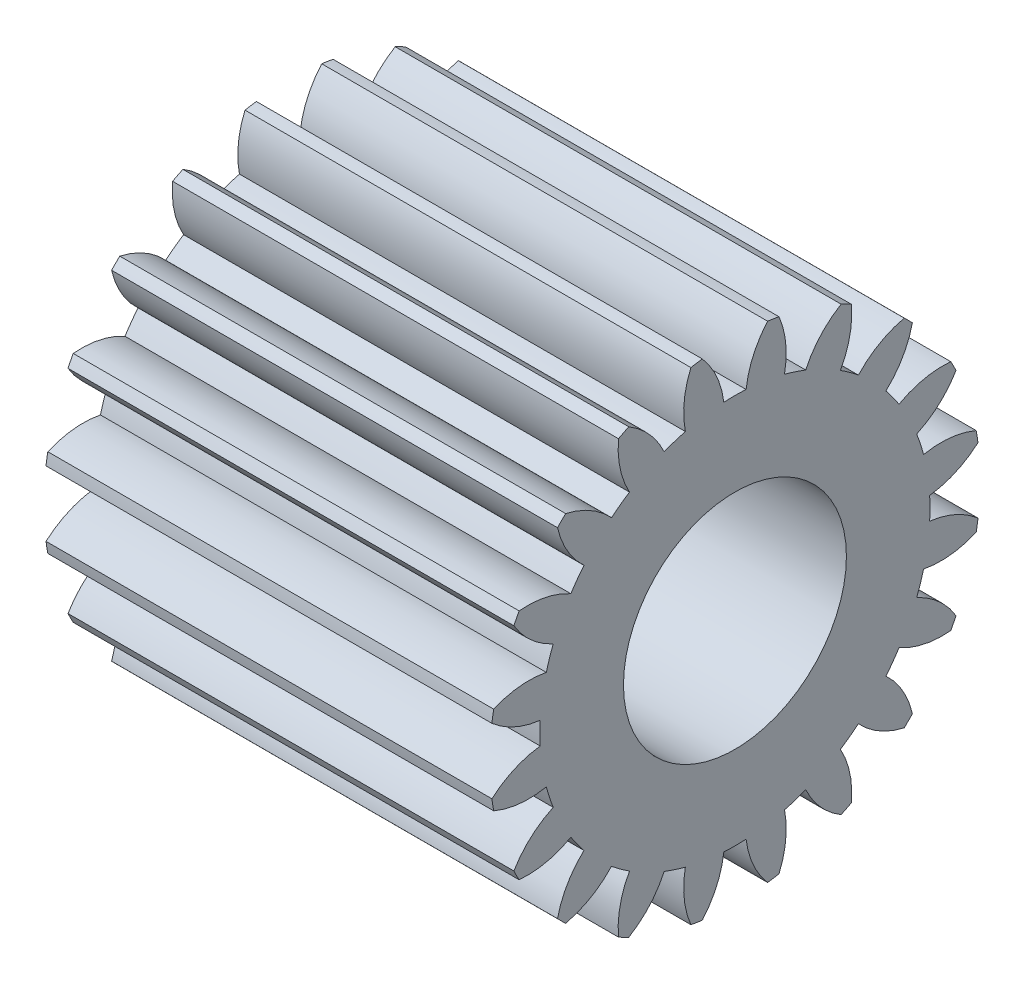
SolidWorks part; units mm, degrees
ref_plane "Plane1" through (0, 0, 0) normal (0, 0, 1) x (1, 0, 0)
ref_plane "Plane2" through (0, 0, 0) normal (0, 1, 0) x (1, 0, 0)
ref_plane "Plane3" through (0, 0, 0) normal (1, 0, 0) x (0, 0, -1)
other "Configuration Table"
sketch "HoldingSke" plane through (0, 0, 0) normal (0, 1, 0) x (1, 0, 0)
  line L0 (0, 0) -> (1.8794, -0.684)
  line L1 (-15, 0) -> (100, 0) construction
  line L2 (0, 0) -> (-2.1039, 2.3779)
  line L3 (0, 0) -> (-11.863, 4.5341)
  line L4 (0, 0) -> (8.1152, 2.9537)
  line L5 (0, 0) -> (-46.8476, -17.4728)
  line L6 (0, 0) -> (-8.2896, -5.593)
  line L7 (-2.1039, 2.3779) -> (8.6586, 51.2059)
  line L8 (-76.2, 54.61) -> (-75.3, 54.61)
  line L9 (-71.009, 38.7566) -> (-53.1078, 45.2721)
  line L10 (-76.2, 71.12) -> (104.1128, 71.12)
  line L11 (0, 0) -> (-10, 0)
  line L12 (-76.2, 101.6) -> (-76.181, 101.6)
  line L13 (24.9733, 27.94) -> (52.9518, 28.4284)
  line L14 (24.9733, 27.94) -> (24.9743, 27.94)
  line L15 (24.9733, 27.94) -> (100.4006, 29.5858)
  line L16 (-63.627, -0.5) -> (-12.827, -0.5)
  circle A0 centre (0, 0) radius 2.5
  circle A1 centre (0, 0) radius 4.374
  circle A2 centre (0, 0) radius 37.5
  circle A3 centre (0, 0) radius 2.5
sketch "BasProSke" plane through (0, 0, 0) normal (0, 1, 0) x (1, 0, 0)
  line L0 (-10, 0) -> (60, 0) construction
  line L1 (0, 0) -> (0, 5.5)
  line L2 (0, 0) -> (10, 0)
  line L3 (10, 0) -> (10, 5.5)
  line L4 (10, 5.5) -> (0, 5.5)
revolve "Base-Revolve" add sketch "BasProSke" angle 360 about L0
sketch "TooCutSke" plane through (0, 0, 0) normal (1, 0, 0) x (0, 0, -1)
  line L1 (0, 0) -> (0, 107) construction
  line L2 (0, 0) -> (-0.4255, 4.9819) construction
  line L3 (0, 0) -> (-1.5603, 9.8514) construction
  line L4 (-0.4255, 4.9819) -> (-0.7802, 4.9257) construction
  arc A0 (0.2499, 4.3669) -> (-0.2499, 4.3669) centre (0, 0) ccw
  arc A1 (0.7528, 5.4739) -> (-0.7528, 5.4739) centre (0, 0) ccw
  circle A2 centre (0, 0) radius 5 construction
  circle A3 centre (0, 0) radius 4.6985 construction
  arc A4 (-0.2499, 4.3669) -> (-0.7528, 5.4739) centre (-2.2361, 4.1322) ccw
  arc A5 (0.7528, 5.4739) -> (0.2499, 4.3669) centre (2.2361, 4.1322) ccw
extrude "ToothCut" cut sketch "TooCutSke" along normal through all
fillet "Breaks" [suppressed] radius 0.01
fillet "RootFillets" [suppressed] radius 0.126
pattern_circular "TeethCuts" count 20 every 18 about axis through (-10, 0, 0) along (1, 0, 0) of "ToothCut", "RootFillets", "Breaks"
sketch "HubNeaOneSke" plane through (0, 0, 0) normal (-1, 0, 0) x (0, 0, 1)
  circle A0 centre (0, 0) radius 4.374
extrude "HubNearOne" [suppressed] add sketch "HubNeaOneSke" along normal blind 40.0001
sketch "HubNeaBotSke" plane through (0, 0, 0) normal (-1, 0, 0) x (0, 0, 1)
  circle A0 centre (0, 0) radius 4.374
extrude "HubNearBoth" [suppressed] add sketch "HubNeaBotSke" along normal blind 20
ref_plane "FarPln" through (10, 0, 0) normal (1, 0, 0) x (0, 0, -1)
sketch "HubFarSke" plane through (10, 0, 0) normal (1, 0, 0) x (0, 0, -1)
  circle A0 centre (0, 0) radius 4.374
extrude "HubFar" [suppressed] add sketch "HubFarSke" along normal blind 20
sketch "BorSke" plane through (0, 0, 0) normal (1, 0, 0) x (0, 0, -1)
  circle A0 centre (0, 0) radius 2.5
extrude "Bore" cut sketch "BorSke" along normal mid plane 100.0001
sketch "KeySke" plane through (0, 0, 0) normal (1, 0, 0) x (0, 0, -1)
  line L0 (-1, 0) -> (-1, 3.4)
  line L1 (-1, 3.4) -> (1, 3.4)
  line L2 (1, 3.4) -> (1, 0)
  line L3 (0, 0) -> (0, 34) construction
  line L4 (-1, 0) -> (1, 0)
extrude "Keyway" [suppressed] cut sketch "KeySke" along normal mid plane 100.0001
pattern_circular "Keyway2" [suppressed] count 2 every 90 about axis through (-10, 0, 0) along (1, 0, 0)
equation "' \"Module@HoldingSke\" = 6.35"
equation "' \"Num_teeth@HoldingSke\" = 12"
equation "' \"Ap@HoldingSke\" =  20"
equation "' \"Ap@HoldingSke\" = 20"
equation "' \"Width@HoldingSke\" = 0.5 * 25.4"
equation "' \"Hub_dia@HoldingSke\"= 1 * 25.4"
equation "' \"Hub_dia@HoldingSke\" = 1 * 25.4"
equation "' \"Overall_len@HoldingSke\" = 1.0 * 25.4"
equation "' \"Bore@HoldingSke\" = 0.75 * 25.4"
equation "' \"T_dim@HoldingSke\" = 0.1 * 25.4"
equation "' \"Width@KeySke\" = 0.25 * 25.4"
equation "' \"Show_teeth@HoldingSke\" = 13"
equation "' \"Backlash@HoldingSke\" = 0.009 * 25.4"
equation "' \"Addendum_fac@HoldingSke\" = 1.0"
equation "' \"Dedendum_fac@HoldingSke\" = 1.25"
equation "' \"Dedendum_add@HoldingSke\" = 0.00005 * 25.4"
equation "' \"Clearance_fac@HoldingSke\" = 0.25"
equation "\"Pitch@HoldingSke\" = 1 / \"Module@HoldingSke\""
equation "\"Overcut_dia@TooCutSke\" = (\"Num_teeth@HoldingSke\" + 2 * \"Addendum_fac@HoldingSke\") / \"Pitch@HoldingSke\" + 0.002 * 25.4"
equation "\"Pitch_dia@TooCutSke\" = \"Num_teeth@HoldingSke\" / \"Pitch@HoldingSke\""
equation "\"Base_dia@TooCutSke\" = \"Num_teeth@HoldingSke\" / \"Pitch@HoldingSke\" * cos((\"Ap@HoldingSke\"  * 3.14159265 / 180))"
equation "\"Root_dia@TooCutSke\" = (\"Num_teeth@HoldingSke\" + 2) / \"Pitch@HoldingSke\" - 2 * (\"Addendum_fac@HoldingSke\" + \"Dedendum_fac@HoldingSke\") / \"Pitch@HoldingSke\" - \"Dedendum_add@HoldingSke\" * 2"
equation "\"Half_ang@TooCutSke\" = 180 / \"Num_teeth@HoldingSke\""
equation "\"Half_CT@TooCutSke\" = \"Num_teeth@HoldingSke\" / \"Pitch@HoldingSke\" * sin((3.14159265 / 2 / \"Num_teeth@HoldingSke\")) / 2 - 7 * \"Backlash@HoldingSke\" / 4"
equation "\"Flank_rad@TooCutSke\" = \"Num_teeth@HoldingSke\" / \"Pitch@HoldingSke\" / 5"
equation "\"Radius@RootFillets\" = \"Clearance_fac@HoldingSke\" / \"Pitch@HoldingSke\" + \"Dedendum_add@HoldingSke\""
equation "\"Break_rad@Breaks\" = 0.02 / \"Pitch@HoldingSke\""
equation "\"Thickness@HoldingSke\" = \"Width@HoldingSke\""
equation "\"OAL@HoldingSke\" = \"Thickness@HoldingSke\""
equation "\"MHD@HoldingSke\" = (\"Num_teeth@HoldingSke\" + 2) / \"Pitch@HoldingSke\" - 2 * (\"Addendum_fac@HoldingSke\" + \"Dedendum_fac@HoldingSke\")  / \"Pitch@HoldingSke\" - \"Dedendum_add@HoldingSke\" * 2"
equation "\"MBD@HoldingSke\" = (\"Num_teeth@HoldingSke\" + 2) / \"Pitch@HoldingSke\" - 2 * (\"Addendum_fac@HoldingSke\" + \"Dedendum_fac@HoldingSke\")  / \"Pitch@HoldingSke\" - \"Dedendum_add@HoldingSke\" * 2 - 0.002 * 25.4"
equation "\"MHD@HoldingSke\" = ((sgn( \"MHD@HoldingSke\" - \"Hub_dia@HoldingSke\" )-1)*( \"MHD@HoldingSke\" - \"Hub_dia@HoldingSke\" ))/-2+ \"Hub_dia@HoldingSke\""
equation "\"MBD@HoldingSke\" = ((sgn( \"MBD@HoldingSke\" - \"Bore@HoldingSke\" )-1)*( \"MBD@HoldingSke\" - \"Bore@HoldingSke\" ))/-2+ \"Bore@HoldingSke\""
equation "\"OAL@HoldingSke\" = ((sgn( \"OAL@HoldingSke\" - \"Overall_len@HoldingSke\" )+1)*( \"OAL@HoldingSke\" - \"Overall_len@HoldingSke\" ))/2 + \"Overall_len@HoldingSke\" + 0.000002 * 25.4"
equation "\"Num_teeth@TeethCuts\" = int( \"Show_teeth@HoldingSke\" ) + 1"
equation "\"Num_teeth@TeethCuts\" = ((sgn( \"Num_teeth@TeethCuts\" - \"Num_teeth@HoldingSke\" )-1)*( \"Num_teeth@TeethCuts\" - \"Num_teeth@HoldingSke\" ))/-2+ \"Num_teeth@HoldingSke\""
equation "\"Num_teeth@TeethCuts\" = ((sgn( \"Num_teeth@TeethCuts\" - 2.0)+1)*( \"Num_teeth@TeethCuts\" - 2.0))/2 +2.0"
equation "\"Angle@TeethCuts\" = 360.0 / \"Num_teeth@HoldingSke\""
equation "\"Diameter@BasProSke\" = (\"Num_teeth@HoldingSke\" + 2 * \"Addendum_fac@HoldingSke\") / \"Pitch@HoldingSke\""
equation "\"Thickness@BasProSke\"  = \"Thickness@HoldingSke\""
equation "' \"Fillet_rad@BasProSke\" =  \"Thickness@HoldingSke\" * 0.05"
equation "' \"Fillet_rad@BasProSke\" = \"Thickness@HoldingSke\" * 0.05"
equation "\"MHD@HoldingSke\" = ((sgn( \"MHD@HoldingSke\" - \"Root_dia@TooCutSke\" )-1)*( \"MHD@HoldingSke\" - \"Root_dia@TooCutSke\" ))/-2+ \"Root_dia@TooCutSke\""
equation "\"Diameter@HubNeaOneSke\" = \"MHD@HoldingSke\""
equation "\"Length@HubNearOne\" = \"OAL@HoldingSke\" - \"Thickness@BasProSke\""
equation "\"Diameter@HubNeaBotSke\" = \"MHD@HoldingSke\""
equation "\"Length@HubNearBoth\" = ( \"OAL@HoldingSke\" - \"Thickness@BasProSke\" ) / 2.0"
equation "\"Thickness@FarPln\" = \"Thickness@BasProSke\""
equation "\"Diameter@HubFarSke\" = \"MHD@HoldingSke\""
equation "\"Length@HubFar\" = ( \"OAL@HoldingSke\" - \"Thickness@BasProSke\" ) / 2.0"
equation "\"Diameter@BorSke\" = \"MBD@HoldingSke\""
equation "\"D1@Bore\" = \"OAL@HoldingSke\" * 2.0"
equation "\"D1@Keyway\" = \"OAL@HoldingSke\" * 2.0"
equation "\"Offset@KeySke\" = \"T_dim@HoldingSke\" + \"MBD@HoldingSke\" / 2.0"
